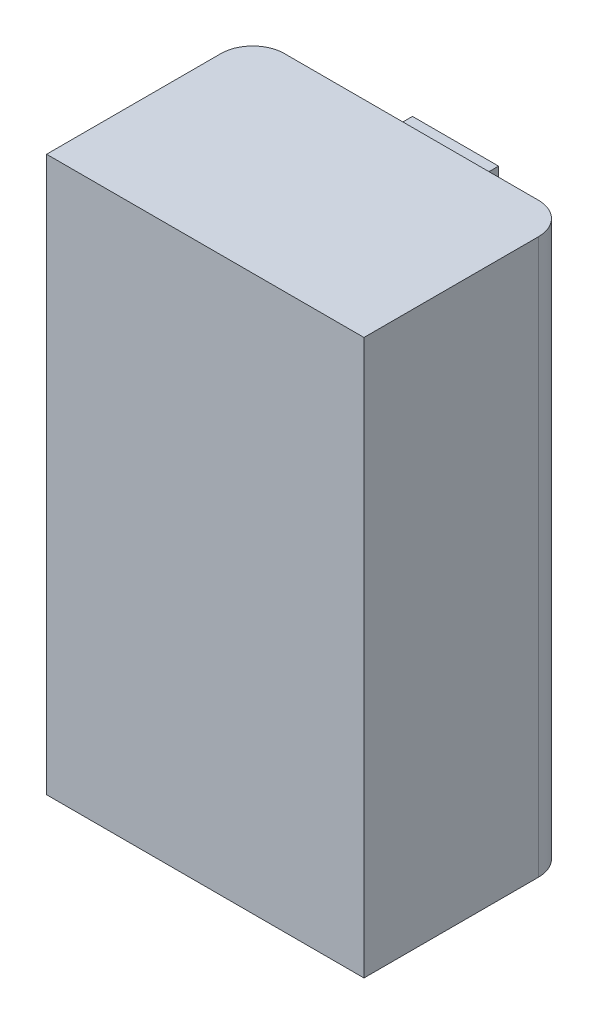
SolidWorks part; units mm, degrees
ref_plane "Front Plane" through (0, 0, 0) normal (0, 0, 1) x (1, 0, 0)
ref_plane "Top Plane" through (0, 0, 0) normal (0, 1, 0) x (1, 0, 0)
ref_plane "Right Plane" through (0, 0, 0) normal (1, 0, 0) x (0, 0, -1)
sketch "Sketch2" plane through (0, 0, 0) normal (0, 1, 0) x (1, 0, 0)
  line L1 (0, 0) -> (20.0259, 0)
  line L2 (0, 0) -> (0, 13.0038)
  line L3 (0, 13.0038) -> (20.0259, 13.0038)
  line L4 (20.0259, 0) -> (20.0259, 13.0038)
extrude "Boss-Extrude1" add sketch "Sketch2" along normal blind 35
sketch "Sketch4" plane through (0, 0, 0) normal (0, -1, 0) x (-1, 0, 0)
  line L5 (-17.4253, 9.8333) -> (-2.6086, 9.8333)
  line L6 (-17.4253, 9.8333) -> (-17.4253, 3.3005)
  line L7 (-17.4253, 3.3005) -> (-2.6086, 3.3005)
  line L8 (-2.6086, 9.8333) -> (-2.6086, 3.3005)
extrude "Cut-Extrude1" cut sketch "Sketch4" against normal blind 6
fillet "Fillet1" radius 2 2 edges at (20.0259, 17.5, -13.0038) (0, 17.5, -13.0038)
sketch "Sketch5" plane through (0, 0, -13.0038) normal (0, 0, -1) x (-1, 0, 0)
  text T0 "DUY 2" font "Franklin Gothic Medium" height in points 22
extrude "Boss-Extrude2" add sketch "Sketch5" along normal blind 1.5
